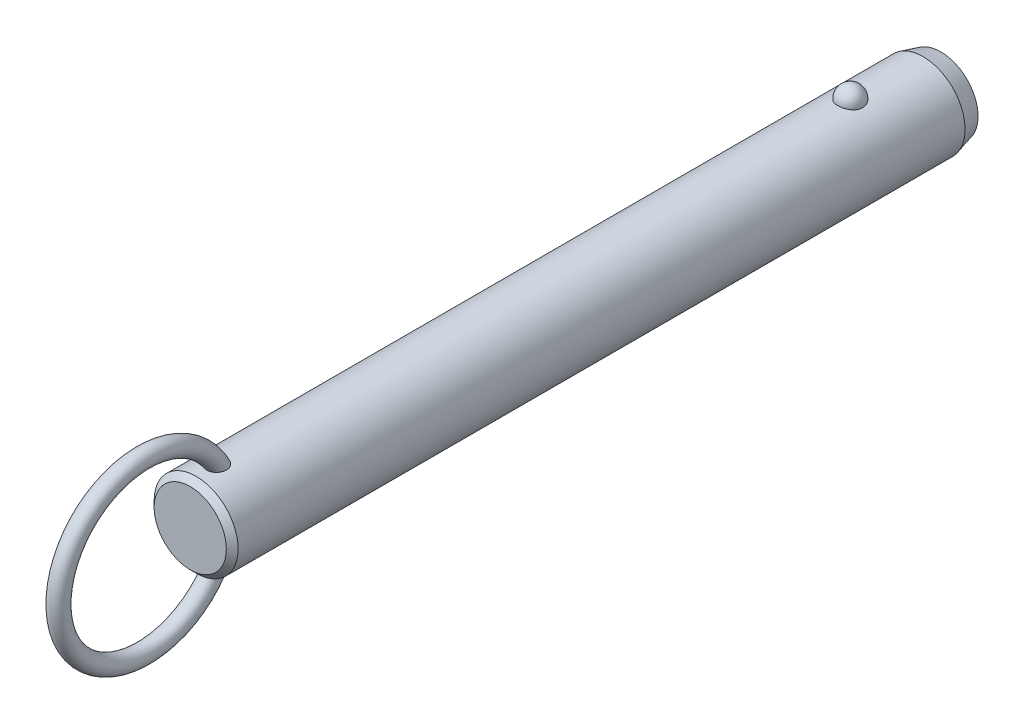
SolidWorks part; units mm, degrees
ref_plane "Front Plane" through (0, 0, 0) normal (0, 0, 1) x (1, 0, 0)
ref_plane "Top Plane" through (0, 0, 0) normal (0, 1, 0) x (1, 0, 0)
ref_plane "Right Plane" through (0, 0, 0) normal (1, 0, 0) x (0, 0, -1)
sketch "Sketch2" plane through (0, 0, 0) normal (0, 0, 1) x (1, 0, 0)
  circle A0 centre (0, 0) radius 7.1
  point P3 (0, 7.1)
  dimension "D1" = 14.2
extrude "Boss-Extrude1" add sketch "Sketch2" along normal blind 101.6
sketch "Sketch3" plane through (0, 0, 0) normal (0, 0, -1) x (-1, 0, 0)
  circle A0 centre (0, 0) radius 7.1
  dimension "D1" = 14.2
extrude "Boss-Extrude2" add sketch "Sketch3" along normal blind 17.4
chamfer "Chamfer1" distance 3 angle 15 1 edges at (-7.1, 0, -17.4)
sketch "Sketch12" plane through (0, 0, 0) normal (1, 0, 0) x (0, 0, -1)
  line L0 (-101.6, 7.1) -> (-101.6, -7.1) construction
  point P0 (-101.6, 0)
sketch "Sketch13" plane through (0, 0, 0) normal (1, 0, 0) x (0, 0, -1)
  circle A0 centre (-117.45, 0) radius 15.85
  point P2 (-101.6, 0)
  dimension "D1" = 31.7
sketch "Sketch14" plane through (0, 0, 0) normal (0, 1, 0) x (1, 0, 0)
  circle A0 centre (0, -103.1) radius 1.5
  point P2 (0, -101.6)
  dimension "D1" = 3
sweep "Sweep1" add profiles "Sketch14" path "Sketch13"
sketch "Sketch15" plane through (0, 0, 101.6) normal (0, 0, 1) x (1, 0, 0)
  circle A0 centre (0, 0) radius 7.1
  dimension "D1" = 14.2
extrude "Boss-Extrude3" add sketch "Sketch15" along normal blind 7.92
chamfer "Chamfer2" distance 1 angle 45 1 edges at (7.1, 0, 109.52)
sketch "Sketch18" plane through (0, 0, 0) normal (1, 0, 0) x (0, 0, -1)
  line L0 (14.4, 7.1) -> (-103.2792, 7.1) construction
  line L1 (2.1, 9.2) -> (2.1, 5)
  line L2 (-103.2792, -7.1) -> (14.4, -7.1) construction
  arc A0 (2.1, 9.2) -> (2.1, 5) centre (2.1, 7.1) ccw
  point P4 (0, 7.1)
  dimension "D1" = 16.3
revolve "Revolve1" add sketch "Sketch18" angle 360 about L1
